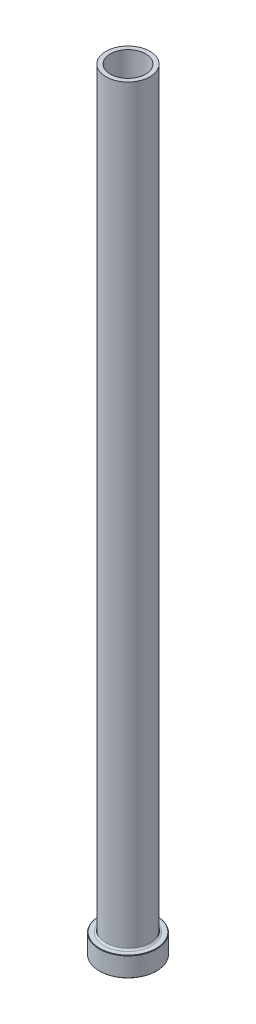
SolidWorks part; units mm, degrees
ref_plane "Front Plane" through (0, 0, 0) normal (0, 0, 1) x (1, 0, 0)
ref_plane "Top Plane" through (0, 0, 0) normal (0, 1, 0) x (1, 0, 0)
ref_plane "Right Plane" through (0, 0, 0) normal (1, 0, 0) x (0, 0, -1)
sketch "Sketch1" plane through (0, 0, 0) normal (0, 0, 1) x (1, 0, 0)
  line L0 (-8, 350) -> (-10, 350)
  line L1 (-10, 350) -> (-10, 9)
  line L2 (-10, 9) -> (-13, 9)
  line L3 (-13, 9) -> (-13, 0)
  line L4 (14.3, 0) -> (-14.3, 0) construction
  line L5 (-13, 0) -> (-8.25, 0)
  line L6 (-8, 295) -> (-8, 350)
  line L7 (0, 92.1877) -> (0, -15.5353) construction
  line L8 (0, -14.3) -> (0, 14.3) construction
  line L9 (-8, 295) -> (-8.25, 283)
  line L10 (-8.25, 283) -> (-8.25, 0)
  dimension "D1" = 0.25
  dimension "ID" = 16
  dimension "OD" = 20
  dimension "L" = 350
  dimension "H" = 26
  dimension "T" = 9
  dimension "N" = 55
  dimension "D2" = 12
revolve "Revolve1" add sketch "Sketch1" angle 360 about L7
fillet "Fillet1" radius 0.8 1 edges at (0, 9, 10)
chamfer "Chamfer1" distance 0.2 angle 45 2 edges at (0, 9, 13) (0, 0, 13)
chamfer "Chamfer3" distance 0.5 angle 45 1 edges at (0, 0, 8.25)
